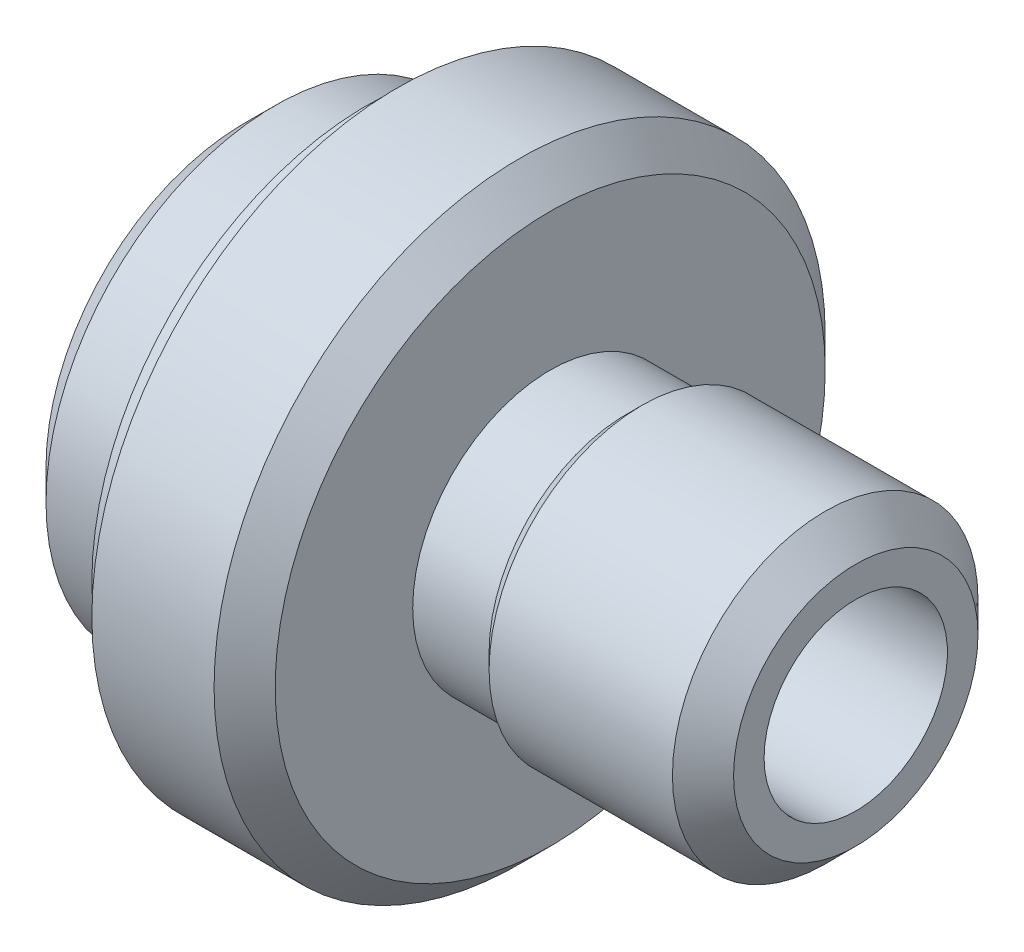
SolidWorks part; units mm, degrees
ref_plane "Plano frontal" through (0, 0, 0) normal (0, 0, 1) x (1, 0, 0)
ref_plane "Plano superior" through (0, 0, 0) normal (0, 1, 0) x (1, 0, 0)
ref_plane "Plano direito" through (0, 0, 0) normal (1, 0, 0) x (0, 0, -1)
sketch "Esboço1" plane through (0, 0, 0) normal (0, 0, 1) x (1, 0, 0)
  line L0 (0, 0) -> (0, -15)
  line L1 (0, -15) -> (8, -15)
  line L2 (8, -15) -> (8, -18)
  line L3 (8, -18) -> (10, -18)
  line L4 (10, -18) -> (10, -20)
  line L5 (10, -20) -> (20, -20)
  line L6 (20, -20) -> (20, -9)
  line L7 (20, -9) -> (24, -9)
  line L8 (24, -9) -> (24, -10)
  line L9 (24, -10) -> (40, -10)
  line L10 (40, -10) -> (40, 0)
  line L11 (0, 0) -> (40, 0)
  point P3 (0, 0)
  point P14 (0, 0)
  point P15 (0, 0)
  point P16 (0, 0)
  point P17 (0, 0)
  point P18 (0, 0)
  dimension "D1" = 15
  dimension "D2" = 18
  dimension "D3" = 9
  dimension "D4" = 10
  dimension "D5" = 20
  dimension "D6" = 8
  dimension "D7" = 10
  dimension "D8" = 4
  dimension "D9" = 10
  dimension "D10" = 20
revolve "Revolução1" add sketch "Esboço1" angle 360 about L11
chamfer "Chanfro1" distance 2 angle 45 3 edges at (20, 0, 20) (40, 0, 10) (0, 0, 15)
chamfer "Chanfro2" distance 2 angle 45 1 edges at (24, 0, 10)
sketch "Esboço2" plane through (0, 0, 0) normal (-1, 0, 0) x (0, 0, 1)
  circle A0 centre (0, 0) radius 6
  dimension "D1" = 12
extrude "Corte-extrusão1" cut sketch "Esboço2" against normal through all and the other way through all
